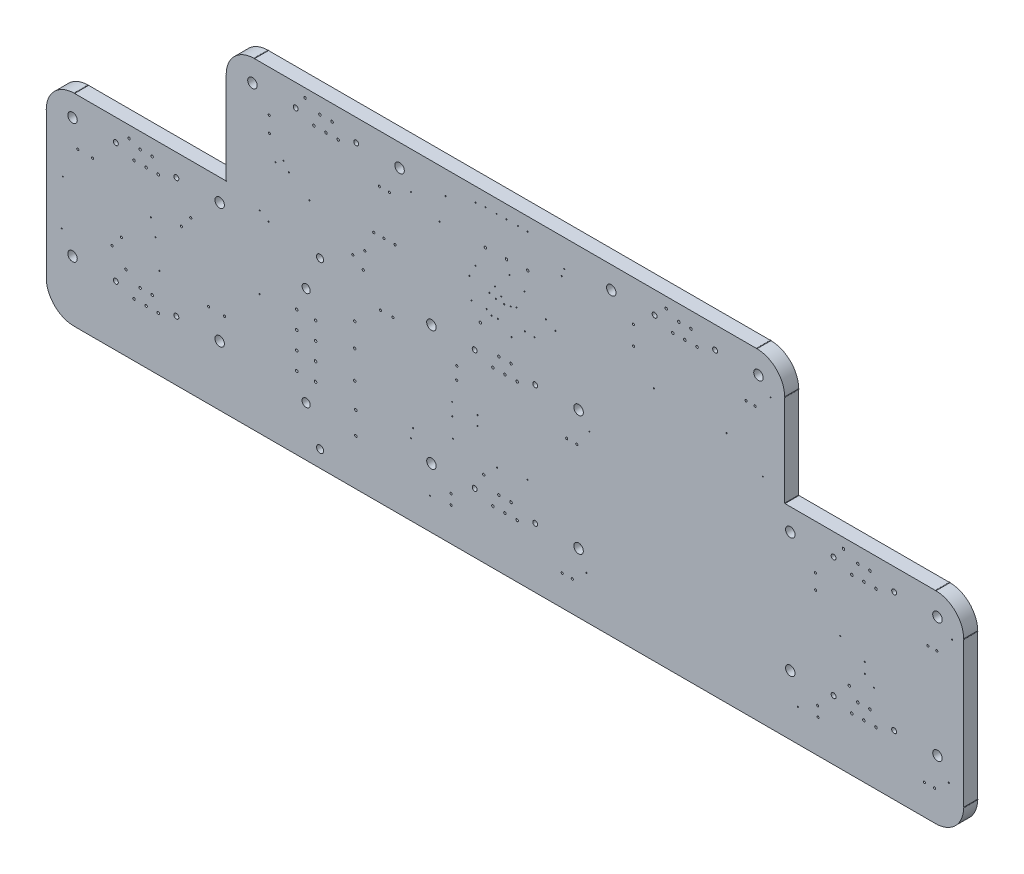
SolidWorks part; units mm, degrees
ref_plane "Front Plane" through (0, 0, 0) normal (0, 0, 1) x (1, 0, 0)
ref_plane "Top Plane" through (0, 0, 0) normal (0, 1, 0) x (1, 0, 0)
ref_plane "Right Plane" through (0, 0, 0) normal (1, 0, 0) x (0, 0, -1)
sketch "Model" plane through (0, 0, 0) normal (0, 0, 1) x (1, 0, 0)
  line L0 (96.1136, 97.917) -> (96.1136, 130.937)
  line L1 (102.4636, 137.287) -> (136.8552, 137.287)
  line L2 (136.8552, 137.287) -> (136.8552, 158.1404)
  line L3 (143.2052, 164.4904) -> (256.9972, 164.4904)
  line L4 (263.3472, 137.287) -> (263.3472, 158.1404)
  line L5 (263.3472, 137.287) -> (297.5356, 137.287)
  line L6 (303.8856, 97.917) -> (303.8856, 130.937)
  line L7 (102.4636, 91.567) -> (297.5356, 91.567)
  circle A0 centre (146.6088, 155.067) radius 0.2413
  circle A1 centre (171.5516, 153.543) radius 0.2413
  circle A2 centre (173.8376, 153.543) radius 0.2413
  circle A3 centre (229.0826, 155.2956) radius 0.2413
  circle A4 centre (254.6096, 153.035) radius 0.2413
  circle A5 centre (256.6416, 153.035) radius 0.2413
  circle A6 centre (170.2816, 143.891) radius 0.2413
  circle A7 centre (172.5676, 143.891) radius 0.2413
  circle A8 centre (175.1076, 143.891) radius 0.2413
  circle A9 centre (168.2496, 139.2936) radius 0.2413
  circle A10 centre (165.5318, 137.1346) radius 0.2413
  circle A11 centre (167.894, 135.3566) radius 0.2413
  circle A12 centre (171.8056, 129.413) radius 0.2413
  circle A13 centre (174.5996, 129.413) radius 0.2413
  circle A14 centre (103.251, 126.6952) radius 0.2413
  circle A15 centre (126.7206, 123.2916) radius 0.2413
  circle A16 centre (128.8288, 126.0348) radius 0.2413
  circle A17 centre (189.0776, 127.127) radius 0.2413
  circle A18 centre (213.9696, 125.349) radius 0.2413
  circle A19 centre (216.2556, 125.349) radius 0.2413
  circle A20 centre (270.3068, 127.1524) radius 0.2413
  circle A21 centre (295.7576, 125.603) radius 0.2413
  circle A22 centre (297.7896, 125.603) radius 0.2413
  circle A23 centre (132.842, 110.6424) radius 0.2413
  circle A24 centre (187.8076, 99.187) radius 0.2413
  circle A25 centre (270.8656, 99.1362) radius 0.2413
  circle A26 centre (113.1316, 114.3762) radius 0.2413
  circle A27 centre (110.998, 111.6838) radius 0.2413
  circle A28 centre (212.9536, 98.425) radius 0.2413
  circle A29 centre (215.2396, 98.425) radius 0.2413
  circle A30 centre (294.9956, 98.425) radius 0.2413
  circle A31 centre (297.2816, 98.425) radius 0.2413
  circle A32 centre (106.6038, 126.619) radius 0.2413
  circle A33 centre (136.4996, 110.5662) radius 0.2413
  circle A34 centre (146.685, 151.5364) radius 0.2413
  circle A35 centre (189.0776, 124.333) radius 0.2413
  circle A36 centre (187.7822, 101.4476) radius 0.2413
  circle A37 centre (229.108, 151.003) radius 0.2413
  circle A38 centre (270.3576, 123.7996) radius 0.2413
  circle A39 centre (270.8148, 101.3714) radius 0.2413
  circle A40 centre (158.115, 132.7658) radius 0.8001
  circle A41 centre (158.115, 95.3262) radius 0.8001
  circle A42 centre (154.9654, 125.2474) radius 0.9207
  circle A43 centre (154.9654, 102.8446) radius 0.9207
  circle A44 centre (152.8318, 120.0658) radius 0.2857
  circle A45 centre (152.8318, 116.0526) radius 0.2858
  circle A46 centre (152.8318, 112.0394) radius 0.2858
  circle A47 centre (152.8318, 108.0262) radius 0.2857
  circle A48 centre (157.099, 120.0658) radius 0.2857
  circle A49 centre (157.099, 116.0526) radius 0.2858
  circle A50 centre (157.099, 112.0394) radius 0.2858
  circle A51 centre (157.099, 108.0262) radius 0.2857
  circle A52 centre (142.7988, 159.4866) radius 1.0731
  circle A53 centre (176.1236, 159.4866) radius 1.0731
  circle A54 centre (152.6032, 159.4866) radius 0.5588
  circle A55 centre (166.3192, 159.4866) radius 0.5588
  circle A56 centre (156.718, 158.0642) radius 0.2858
  circle A57 centre (159.4612, 158.0642) radius 0.2858
  circle A58 centre (162.2044, 158.0642) radius 0.2857
  circle A59 centre (158.0896, 160.909) radius 0.2858
  circle A60 centre (160.8328, 160.909) radius 0.2858
  circle A61 centre (224.0788, 159.4866) radius 1.0731
  circle A62 centre (257.4036, 159.4866) radius 1.0731
  circle A63 centre (233.8832, 159.4866) radius 0.5588
  circle A64 centre (247.5992, 159.4866) radius 0.5588
  circle A65 centre (237.998, 158.0642) radius 0.2857
  circle A66 centre (240.7412, 158.0642) radius 0.2858
  circle A67 centre (243.4844, 158.0642) radius 0.2858
  circle A68 centre (239.3696, 160.909) radius 0.2858
  circle A69 centre (242.1128, 160.909) radius 0.2858
  circle A70 centre (102.0572, 132.3086) radius 1.0731
  circle A71 centre (135.382, 132.3086) radius 1.0731
  circle A72 centre (111.8616, 132.3086) radius 0.5588
  circle A73 centre (125.5776, 132.3086) radius 0.5588
  circle A74 centre (115.9764, 130.8862) radius 0.2858
  circle A75 centre (118.7196, 130.8862) radius 0.2858
  circle A76 centre (121.4628, 130.8862) radius 0.2858
  circle A77 centre (117.348, 133.731) radius 0.2858
  circle A78 centre (120.0912, 133.731) radius 0.2858
  circle A79 centre (183.3372, 132.3086) radius 1.0731
  circle A80 centre (216.662, 132.3086) radius 1.0731
  circle A81 centre (193.1416, 132.3086) radius 0.5588
  circle A82 centre (206.8576, 132.3086) radius 0.5588
  circle A83 centre (197.2564, 130.8862) radius 0.2858
  circle A84 centre (199.9996, 130.8862) radius 0.2858
  circle A85 centre (202.7428, 130.8862) radius 0.2858
  circle A86 centre (198.628, 133.731) radius 0.2858
  circle A87 centre (201.3712, 133.731) radius 0.2858
  circle A88 centre (264.6172, 132.3086) radius 1.0732
  circle A89 centre (297.942, 132.3086) radius 1.0731
  circle A90 centre (274.4216, 132.3086) radius 0.5588
  circle A91 centre (288.1376, 132.3086) radius 0.5588
  circle A92 centre (278.5364, 130.8862) radius 0.2858
  circle A93 centre (281.2796, 130.8862) radius 0.2857
  circle A94 centre (284.0228, 130.8862) radius 0.2857
  circle A95 centre (279.908, 133.731) radius 0.2857
  circle A96 centre (282.6512, 133.731) radius 0.2858
  circle A97 centre (102.0572, 105.1306) radius 1.0731
  circle A98 centre (135.382, 105.1306) radius 1.0731
  circle A99 centre (111.8616, 105.1306) radius 0.5588
  circle A100 centre (125.5776, 105.1306) radius 0.5588
  circle A101 centre (115.9764, 103.7082) radius 0.2858
  circle A102 centre (118.7196, 103.7082) radius 0.2858
  circle A103 centre (121.4628, 103.7082) radius 0.2858
  circle A104 centre (117.348, 106.553) radius 0.2858
  circle A105 centre (120.0912, 106.553) radius 0.2858
  circle A106 centre (183.3372, 105.1306) radius 1.0731
  circle A107 centre (216.662, 105.1306) radius 1.0731
  circle A108 centre (193.1416, 105.1306) radius 0.5588
  circle A109 centre (206.8576, 105.1306) radius 0.5588
  circle A110 centre (197.2564, 103.7082) radius 0.2858
  circle A111 centre (199.9996, 103.7082) radius 0.2858
  circle A112 centre (202.7428, 103.7082) radius 0.2858
  circle A113 centre (198.628, 106.553) radius 0.2858
  circle A114 centre (201.3712, 106.553) radius 0.2858
  circle A115 centre (264.6172, 105.1306) radius 1.0732
  circle A116 centre (297.942, 105.1306) radius 1.0731
  circle A117 centre (274.4216, 105.1306) radius 0.5588
  circle A118 centre (288.1376, 105.1306) radius 0.5588
  circle A119 centre (278.5364, 103.7082) radius 0.2858
  circle A120 centre (281.2796, 103.7082) radius 0.2857
  circle A121 centre (284.0228, 103.7082) radius 0.2857
  circle A122 centre (279.908, 106.553) radius 0.2857
  circle A123 centre (282.6512, 106.553) radius 0.2858
  circle A124 centre (154.7114, 162.5092) radius 0.273
  circle A125 centre (236.4994, 162.0774) radius 0.273
  circle A126 centre (205.1558, 153.8732) radius 0.273
  circle A127 centre (195.5546, 153.5938) radius 0.273
  circle A128 centre (200.3298, 153.67) radius 0.273
  circle A129 centre (194.4116, 138.303) radius 0.273
  circle A130 centre (114.8588, 134.6454) radius 0.273
  circle A131 centre (276.6568, 135.0518) radius 0.273
  circle A132 centre (165.9636, 124.333) radius 0.273
  circle A133 centre (165.9636, 118.999) radius 0.273
  circle A134 centre (165.9636, 112.649) radius 0.273
  circle A135 centre (114.1476, 108.585) radius 0.273
  circle A136 centre (166.2176, 107.061) radius 0.273
  circle A137 centre (195.1736, 108.839) radius 0.273
  circle A138 centre (277.9776, 108.839) radius 0.273
  circle A139 centre (166.2176, 101.981) radius 0.273
  circle A140 centre (213.4108, 158.2928) radius 0.127
  circle A141 centre (96.1136, 97.917) radius 0.0635
  circle A142 centre (96.1136, 130.937) radius 0.0635
  circle A143 centre (102.4636, 137.287) radius 0.0635
  circle A144 centre (136.8552, 137.287) radius 0.0635
  circle A145 centre (136.8552, 137.287) radius 0.0635
  circle A146 centre (136.8552, 158.1404) radius 0.0635
  circle A147 centre (143.2052, 164.4904) radius 0.0635
  circle A148 centre (256.9972, 164.4904) radius 0.0635
  circle A149 centre (263.3472, 137.287) radius 0.0635
  circle A150 centre (263.3472, 158.1404) radius 0.0635
  circle A151 centre (263.3472, 137.287) radius 0.0635
  circle A152 centre (297.5356, 137.287) radius 0.0635
  circle A153 centre (303.8856, 97.917) radius 0.0635
  circle A154 centre (303.8856, 130.937) radius 0.0635
  circle A155 centre (102.4636, 91.567) radius 0.0635
  circle A156 centre (297.5356, 91.567) radius 0.0635
  arc A281 (102.4636, 137.287) -> (96.1136, 130.937) centre (102.4492, 130.9514) ccw
  circle A282 centre (96.1136, 130.937) radius 0.0635
  circle A283 centre (102.4636, 137.287) radius 0.0635
  arc A284 (143.2052, 164.4904) -> (136.8552, 158.1404) centre (143.1857, 158.1599) ccw
  circle A285 centre (136.8552, 158.1404) radius 0.0635
  circle A286 centre (143.2052, 164.4904) radius 0.0635
  arc A287 (263.3472, 158.1404) -> (256.9972, 164.4904) centre (257.0002, 158.1434) ccw
  circle A288 centre (256.9972, 164.4904) radius 0.0635
  circle A289 centre (263.3472, 158.1404) radius 0.0635
  arc A290 (303.8856, 130.937) -> (297.5356, 137.287) centre (297.5292, 130.9306) ccw
  circle A291 centre (297.5356, 137.287) radius 0.0635
  circle A292 centre (303.8856, 130.937) radius 0.0635
  arc A293 (297.5356, 91.567) -> (303.8856, 97.917) centre (297.5254, 97.9272) ccw
  circle A294 centre (303.8856, 97.917) radius 0.0635
  circle A295 centre (297.5356, 91.567) radius 0.0635
  arc A296 (96.1136, 97.917) -> (102.4636, 91.567) centre (102.4441, 97.8975) ccw
  circle A297 centre (102.4636, 91.567) radius 0.0635
  circle A298 centre (96.1136, 97.917) radius 0.0635
  circle A299 centre (182.9816, 98.6282) radius 0.127
  circle A300 centre (196.469, 145.161) radius 0.127
  circle A301 centre (211.4296, 145.161) radius 0.127
  circle A302 centre (281.4828, 115.2737) radius 0.127
  circle A303 centre (281.5336, 112.9453) radius 0.127
  circle A304 centre (144.4498, 135.3058) radius 0.127
  circle A305 centre (258.3942, 140.081) radius 0.127
  circle A306 centre (197.9253, 144.6953) radius 0.127
  circle A307 centre (155.702, 142.9004) radius 0.127
  circle A308 centre (148.0312, 146.5326) radius 0.127
  circle A309 centre (202.5819, 145.3303) radius 0.127
  circle A310 centre (201.3119, 144.907) radius 0.127
  circle A311 centre (149.8092, 147.7518) radius 0.127
  circle A312 centre (199.8218, 144.5768) radius 0.127
  circle A313 centre (146.4903, 134.112) radius 0.127
  circle A314 centre (191.9732, 146.2278) radius 0.127
  circle A315 centre (197.7136, 147.0237) radius 0.127
  circle A316 centre (199.1614, 145.7706) radius 0.127
  circle A317 centre (209.3045, 146.3548) radius 0.127
  circle A318 centre (266.3444, 98.8822) radius 0.127
  circle A319 centre (198.1708, 111.7346) radius 0.127
  circle A320 centre (198.374, 141.0208) radius 0.127
  circle A321 centre (204.4446, 149.4028) radius 0.127
  circle A322 centre (201.0156, 150.9268) radius 0.127
  circle A323 centre (205.1304, 112.8014) radius 0.127
  circle A324 centre (196.977, 140.9192) radius 0.127
  circle A325 centre (144.399, 118.872) radius 0.127
  circle A326 centre (195.8594, 141.6558) radius 0.127
  circle A327 centre (192.4304, 141.6304) radius 0.127
  circle A328 centre (260.1722, 156.464) radius 0.127
  circle A329 centre (188.0616, 116.713) radius 0.127
  circle A330 centre (193.802, 119.8118) radius 0.127
  circle A331 centre (301.244, 129.54) radius 0.127
  circle A332 centre (185.166, 153.4668) radius 0.127
  circle A333 centre (99.8728, 119.6679) radius 0.127
  circle A334 centre (218.4146, 101.219) radius 0.127
  circle A335 centre (300.5074, 101.092) radius 0.127
  circle A336 centre (178.689, 156.0322) radius 0.127
  circle A337 centre (193.294, 148.8948) radius 0.127
  circle A338 centre (205.1304, 161.4678) radius 0.127
  circle A339 centre (200.3552, 161.4932) radius 0.127
  circle A340 centre (195.5546, 161.5186) radius 0.127
  circle A341 centre (188.0362, 119.5324) radius 0.127
  circle A342 centre (193.802, 117.7036) radius 0.127
  circle A343 centre (275.9202, 117.5766) radius 0.127
  circle A344 centre (206.6544, 141.5542) radius 0.127
  circle A345 centre (219.1004, 129.2606) radius 0.127
  circle A346 centre (233.7308, 145.0594) radius 0.127
  circle A347 centre (151.0538, 146.0754) radius 0.127
  circle A348 centre (188.2394, 112.395) radius 0.127
  circle A349 centre (119.8203, 121.6237) radius 0.127
  circle A350 centre (120.8786, 118.237) radius 0.127
  circle A351 centre (121.7422, 112.1156) radius 0.127
  circle A352 centre (99.6188, 109.347) radius 0.127
  circle A353 centre (204.5208, 141.6304) radius 0.127
  circle A354 centre (201.5236, 138.9803) radius 0.127
  circle A355 centre (179.1716, 109.9566) radius 0.127
  circle A356 centre (178.7398, 107.7468) radius 0.127
  circle A357 centre (283.591, 111.252) radius 0.127
  circle A358 centre (198.12, 161.4424) radius 0.127
  circle A359 centre (202.9206, 161.4932) radius 0.127
  circle A360 centre (212.852, 156.6164) radius 0.127
  circle A361 centre (193.3448, 161.2646) radius 0.127
  circle A362 centre (186.563, 159.1564) radius 0.127
  circle A363 centre (250.1646, 144.5006) radius 0.127
extrude "Boss-Extrude1" add sketch "Model" along normal blind 3.175
